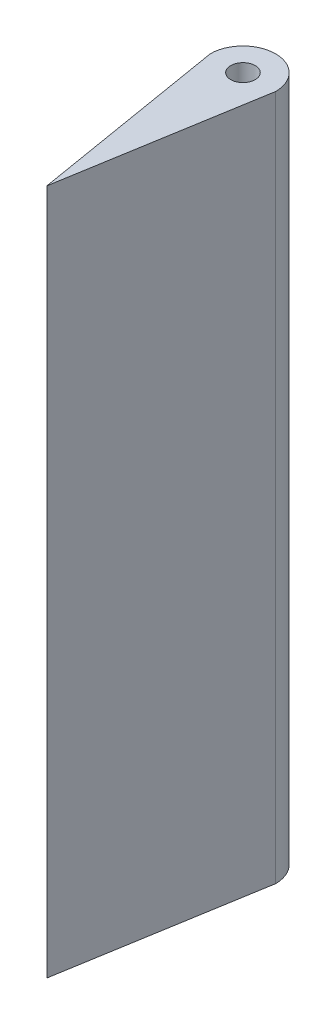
SolidWorks part; units mm, degrees
ref_plane "Front Plane" through (0, 0, 0) normal (0, 0, 1) x (1, 0, 0)
ref_plane "Top Plane" through (0, 0, 0) normal (0, 1, 0) x (1, 0, 0)
ref_plane "Right Plane" through (0, 0, 0) normal (1, 0, 0) x (0, 0, -1)
sketch "Sketch1" plane through (0, 0, 0) normal (0, 1, 0) x (1, 0, 0)
  line L0 (0, 0) -> (0, -25.4) construction
  line L1 (-4.2333, 0) -> (0, -25.4)
  line L2 (0, -25.4) -> (4.2333, 0)
  arc A0 (4.2333, 0) -> (-4.2333, 0) centre (0, 0) ccw
  dimension "D1" = 8.4667
  dimension "D2" = 25.4
extrude "Boss-Extrude1" add sketch "Sketch1" along normal blind 88.9
sketch "Sketch2" plane through (0, 88.9, 0) normal (0, 1, 0) x (1, 0, 0)
  circle A0 centre (0, 0) radius 1.5875
  dimension "D1" = 3.175
extrude "Cut-Extrude1" cut sketch "Sketch2" against normal through all
